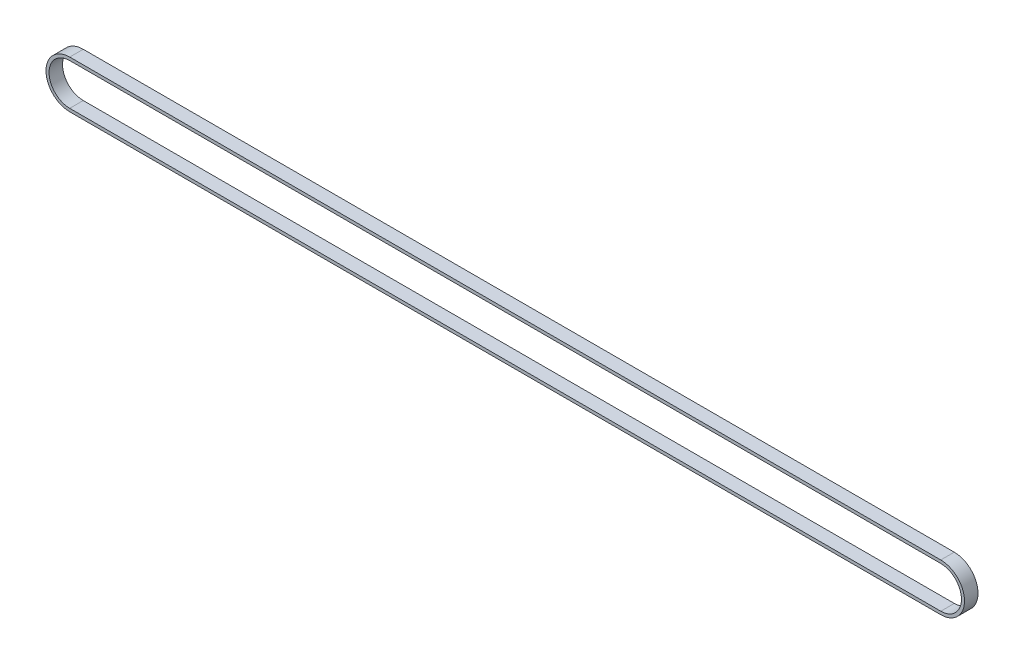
SolidWorks part; units mm, degrees
ref_plane "Front Plane" through (0, 0, 0) normal (0, 0, 1) x (1, 0, 0)
ref_plane "Top Plane" through (0, 0, 0) normal (0, 1, 0) x (1, 0, 0)
ref_plane "Right Plane" through (0, 0, 0) normal (1, 0, 0) x (0, 0, -1)
sketch "Sketch1" plane through (0, 0, 0) normal (0, 0, 1) x (1, 0, 0)
  point P0 (0, 0)
  line B0 (193.5, 0) -> (-193.5, 0) construction
  circle B1 centre (-193.5, 0) radius 9.181 construction
  circle B2 centre (193.5, 0) radius 9.181 construction
sketch_block_instance "Block1-1"
sketch_block "Block1"
sketch "Sketch2" plane through (0, 0, 0) normal (0, 0, 1) x (1, 0, 0)
  line L0 (-193.5, 9.181) -> (193.5, 9.181)
  line L1 (-193.5, -9.181) -> (193.5, -9.181)
  line L2 (-193.5, 10.541) -> (193.5, 10.541)
  line L3 (-193.5, -10.541) -> (193.5, -10.541)
  arc A0 (-193.5, 9.181) -> (-193.5, -9.181) centre (-193.5, 0) ccw
  arc A1 (193.5, -9.181) -> (193.5, 9.181) centre (193.5, 0) ccw
  circle A2 centre (193.5, 0) radius 9.181 construction
  circle A3 centre (-193.5, 0) radius 9.181 construction
  arc A4 (193.5, -10.541) -> (193.5, 10.541) centre (193.5, 0) ccw
  arc A5 (-193.5, 10.541) -> (-193.5, -10.541) centre (-193.5, 0) ccw
  dimension "D1" = 1.36
extrude "Boss-Extrude1" add sketch "Sketch2" along normal mid plane 6
